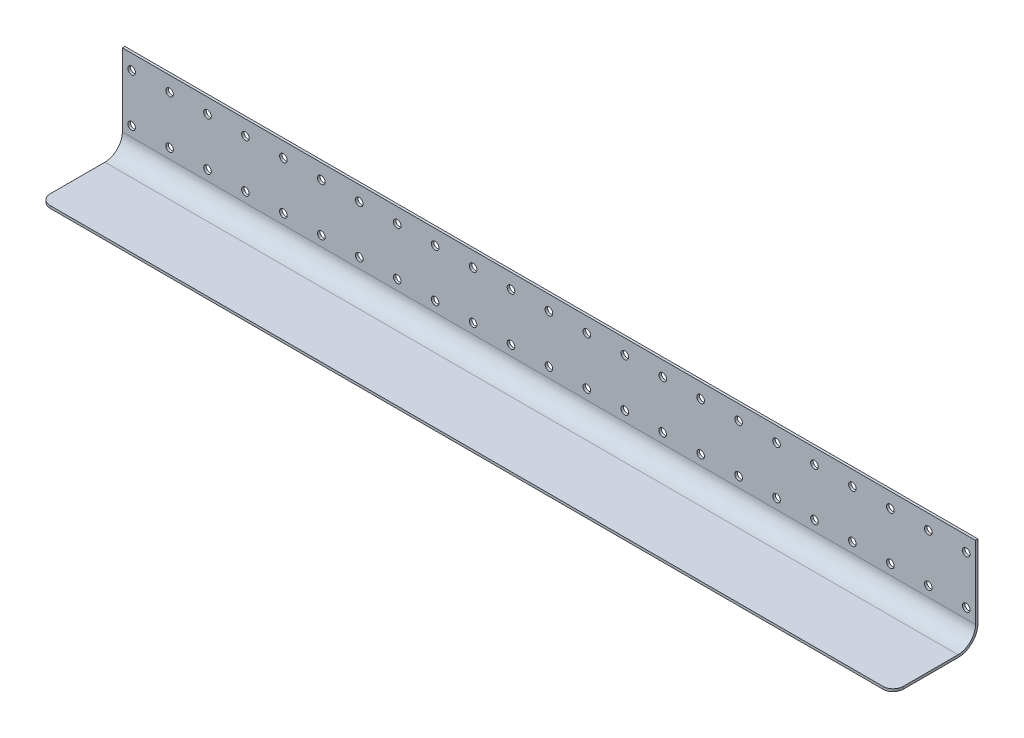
SolidWorks part; units mm, degrees
ref_plane "Front Plane" through (0, 0, 0) normal (1, 0, 0) x (0, 1, 0)
ref_plane "Top Plane" through (0, 0, 0) normal (0, 0, 1) x (0, 1, 0)
ref_plane "Right Plane" through (0, 0, 0) normal (0, 1, 0) x (-1, 0, 0)
sketch "sk 5dia hole pat" plane through (0, 0, 0) normal (0, 0, 1) x (0, 1, 0)
  line L4 (-30.48, -48.26) -> (30.48, -48.26) construction
  point P3 (0, -48.26)
  circle B0 centre (30.48, -579.12) radius 4.826
  circle B1 centre (1188.72, 579.12) radius 4.826
  circle B2 centre (78.74, -579.12) radius 4.826
  circle B3 centre (127, -579.12) radius 4.826
  circle B4 centre (175.26, -579.12) radius 4.826
  circle B5 centre (223.52, -579.12) radius 4.826
  circle B6 centre (271.78, -579.12) radius 4.826
  circle B7 centre (320.04, -579.12) radius 4.826
  circle B8 centre (368.3, -579.12) radius 4.826
  circle B9 centre (416.56, -579.12) radius 4.826
  circle B10 centre (464.82, -579.12) radius 4.826
  circle B11 centre (513.08, -579.12) radius 4.826
  circle B12 centre (561.34, -579.12) radius 4.826
  circle B13 centre (609.6, -579.12) radius 4.826
  circle B14 centre (657.86, -579.12) radius 4.826
  circle B15 centre (706.12, -579.12) radius 4.826
  circle B16 centre (754.38, -579.12) radius 4.826
  circle B17 centre (802.64, -579.12) radius 4.826
  circle B18 centre (850.9, -579.12) radius 4.826
  circle B19 centre (899.16, -579.12) radius 4.826
  circle B20 centre (947.42, -579.12) radius 4.826
  circle B21 centre (995.68, -579.12) radius 4.826
  circle B22 centre (1043.94, -579.12) radius 4.826
  circle B23 centre (1092.2, -579.12) radius 4.826
  circle B24 centre (1140.46, -579.12) radius 4.826
  circle B25 centre (1188.72, -579.12) radius 4.826
  circle B26 centre (30.48, -530.86) radius 4.826
  circle B27 centre (30.48, -482.6) radius 4.826
  circle B28 centre (30.48, -434.34) radius 4.826
  circle B29 centre (30.48, -386.08) radius 4.826
  circle B30 centre (30.48, -337.82) radius 4.826
  circle B31 centre (30.48, -289.56) radius 4.826
  circle B32 centre (30.48, -241.3) radius 4.826
  circle B33 centre (30.48, -193.04) radius 4.826
  circle B34 centre (30.48, -144.78) radius 4.826
  circle B35 centre (30.48, -96.52) radius 4.826
  circle B36 centre (30.48, -48.26) radius 4.826
  circle B37 centre (30.48, 0) radius 4.826
  circle B38 centre (30.48, 48.26) radius 4.826
  circle B39 centre (30.48, 96.52) radius 4.826
  circle B40 centre (30.48, 144.78) radius 4.826
  circle B41 centre (30.48, 193.04) radius 4.826
  circle B42 centre (30.48, 241.3) radius 4.826
  circle B43 centre (30.48, 289.56) radius 4.826
  circle B44 centre (30.48, 337.82) radius 4.826
  circle B45 centre (30.48, 386.08) radius 4.826
  circle B46 centre (30.48, 434.34) radius 4.826
  circle B47 centre (30.48, 482.6) radius 4.826
  circle B48 centre (30.48, 530.86) radius 4.826
  circle B49 centre (30.48, 579.12) radius 4.826
  circle B50 centre (1140.46, 579.12) radius 4.826
  circle B51 centre (1092.2, 579.12) radius 4.826
  circle B52 centre (1043.94, 579.12) radius 4.826
  circle B53 centre (995.68, 579.12) radius 4.826
  circle B54 centre (947.42, 579.12) radius 4.826
  circle B55 centre (899.16, 579.12) radius 4.826
  circle B56 centre (850.9, 579.12) radius 4.826
  circle B57 centre (802.64, 579.12) radius 4.826
  circle B58 centre (754.38, 579.12) radius 4.826
  circle B59 centre (706.12, 579.12) radius 4.826
  circle B60 centre (657.86, 579.12) radius 4.826
  circle B61 centre (609.6, 579.12) radius 4.826
  circle B62 centre (561.34, 579.12) radius 4.826
  circle B63 centre (513.08, 579.12) radius 4.826
  circle B64 centre (464.82, 579.12) radius 4.826
  circle B65 centre (416.56, 579.12) radius 4.826
  circle B66 centre (368.3, 579.12) radius 4.826
  circle B67 centre (320.04, 579.12) radius 4.826
  circle B68 centre (271.78, 579.12) radius 4.826
  circle B69 centre (223.52, 579.12) radius 4.826
  circle B70 centre (175.26, 579.12) radius 4.826
  circle B71 centre (127, 579.12) radius 4.826
  circle B72 centre (78.74, 579.12) radius 4.826
  circle B73 centre (1188.72, 530.86) radius 4.826
  circle B74 centre (1188.72, 482.6) radius 4.826
  circle B75 centre (1188.72, 434.34) radius 4.826
  circle B76 centre (1188.72, 386.08) radius 4.826
  circle B77 centre (1188.72, 337.82) radius 4.826
  circle B78 centre (1188.72, 289.56) radius 4.826
  circle B79 centre (1188.72, 241.3) radius 4.826
  circle B80 centre (1188.72, 193.04) radius 4.826
  circle B81 centre (1188.72, 144.78) radius 4.826
  circle B82 centre (1188.72, 96.52) radius 4.826
  circle B83 centre (1188.72, 48.26) radius 4.826
  circle B84 centre (1188.72, 0) radius 4.826
  circle B85 centre (1188.72, -48.26) radius 4.826
  circle B86 centre (1188.72, -96.52) radius 4.826
  circle B87 centre (1188.72, -144.78) radius 4.826
  circle B88 centre (1188.72, -193.04) radius 4.826
  circle B89 centre (1188.72, -241.3) radius 4.826
  circle B90 centre (1188.72, -289.56) radius 4.826
  circle B91 centre (1188.72, -337.82) radius 4.826
  circle B92 centre (1188.72, -386.08) radius 4.826
  circle B93 centre (1188.72, -434.34) radius 4.826
  circle B94 centre (1188.72, -482.6) radius 4.826
  circle B95 centre (1188.72, -530.86) radius 4.826
  line B96 (609.6, -579.12) -> (609.6, -504.12) construction
  line B97 (30.48, 0) -> (105.48, 0) construction
  circle B98 centre (-30.48, 579.12) radius 4.826
  circle B99 centre (-175.26, -579.12) radius 4.826
  circle B100 centre (-127, -579.12) radius 4.826
  circle B101 centre (-30.48, -579.12) radius 4.826
  circle B102 centre (-1188.72, 96.52) radius 4.826
  circle B103 centre (-127, 579.12) radius 4.826
  circle B104 centre (-464.82, 579.12) radius 4.826
  circle B105 centre (-513.08, 579.12) radius 4.826
  circle B106 centre (-706.12, 579.12) radius 4.826
  circle B107 centre (-754.38, 579.12) radius 4.826
  circle B108 centre (-899.16, 579.12) radius 4.826
  circle B109 centre (-30.48, 530.86) radius 4.826
  circle B110 centre (-30.48, 482.6) radius 4.826
  circle B111 centre (-30.48, 434.34) radius 4.826
  circle B112 centre (-30.48, 386.08) radius 4.826
  circle B113 centre (-30.48, 337.82) radius 4.826
  circle B114 centre (-30.48, 289.56) radius 4.826
  circle B115 centre (-30.48, 241.3) radius 4.826
  circle B116 centre (-30.48, 193.04) radius 4.826
  circle B117 centre (-30.48, 144.78) radius 4.826
  circle B118 centre (-30.48, 96.52) radius 4.826
  circle B119 centre (-30.48, 48.26) radius 4.826
  circle B120 centre (-30.48, 0) radius 4.826
  circle B121 centre (-30.48, -48.26) radius 4.826
  circle B122 centre (-30.48, -96.52) radius 4.826
  circle B123 centre (-30.48, -144.78) radius 4.826
  circle B124 centre (-30.48, -241.3) radius 4.826
  circle B125 centre (-30.48, -289.56) radius 4.826
  circle B126 centre (-30.48, -337.82) radius 4.826
  circle B127 centre (-30.48, -386.08) radius 4.826
  circle B128 centre (-30.48, -434.34) radius 4.826
  circle B129 centre (-30.48, -482.6) radius 4.826
  circle B130 centre (-30.48, -530.86) radius 4.826
  line B131 (-1188.72, 0) -> (-1113.72, 0) construction
  dimension "D1" = 60.96
sketch_block_instance "5dia hole pat-1"
sketch_block "5dia hole pat" parameters "D1"=9.652, "D2"=9.652, "D3"=75
sketch_block_instance "5dia hole pat-2"
sketch "sk 47.986in pnl" plane through (0, 0, 0) normal (0, 0, 1) x (0, 1, 0)
  line B0 (0.1778, 0) -> (1219.0222, 0) construction
  line B1 (0.1778, 609.4222) -> (1219.0222, 609.4222)
  line B2 (0.1778, 609.4222) -> (0.1778, -609.4222)
  line B3 (0.1778, -609.4222) -> (1219.0222, -609.4222)
  line B4 (1219.0222, 609.4222) -> (1219.0222, -609.4222)
  line B5 (609.6, 609.4222) -> (609.6, -609.4222) construction
  dimension "D1" = 30.3022
sketch_block_instance "47.986in pnl-1"
sketch_block "47.986in pnl" parameters "D1"=1218.8444, "D2"=1218.8444
sketch "sk main body" plane through (0, 0, 0) normal (1, 0, 0) x (0, 1, 0)
  line L0 (49.53, 0) -> (-43.18, 0)
  line L1 (-68.58, 25.4) -> (-68.58, 158.75)
  line L2 (-43.18, 184.15) -> (-7.62, 184.15)
  line L3 (-26.67, 213.8401) -> (-26.67, 147.2198) construction
  line L4 (49.53, 3.175) -> (-43.18, 3.175)
  line L5 (-65.405, 25.4) -> (-65.405, 158.75)
  line L6 (-43.18, 180.975) -> (-7.62, 180.975)
  line L7 (-7.62, 184.15) -> (-7.62, 180.975)
  line L8 (49.53, 3.175) -> (49.53, 0)
  line L9 (670.3644, 0) -> (-670.3644, 0) construction
  arc A0 (-43.18, 0) -> (-68.58, 25.4) centre (-43.18, 25.4) cw
  arc A1 (-68.58, 158.75) -> (-43.18, 184.15) centre (-43.18, 158.75) cw
  arc A2 (-43.18, 3.175) -> (-65.405, 25.4) centre (-43.18, 25.4) cw
  arc A3 (-65.405, 158.75) -> (-43.18, 180.975) centre (-43.18, 158.75) cw
  dimension "D2" = 25.4
  dimension "D1" = 19.05
  dimension "D3" = 12.7
  dimension "D4" = 16.51
  dimension "D5" = 19.05
  dimension "D7" = 177.8
  dimension "D6" = 3.175
extrude "main body" add sketch "sk main body" along normal mid plane 1218.8444
sketch "sk upper holes" plane through (0, 0, 184.15) normal (0, 0, 1) x (1, 0, 0)
  line L0 (-609.4222, 0.1778) -> (-609.4222, 1219.0222) construction
  line L1 (609.4222, 0.1778) -> (609.4222, 1219.0222) construction
  line L2 (609.4222, -7.62) -> (-609.4222, -7.62) construction
  circle A2 centre (-342.9, -26.67) radius 16.51 construction
  circle A3 centre (-266.7, -26.67) radius 16.51 construction
  circle A4 centre (266.7, -26.67) radius 16.51 construction
  circle A5 centre (342.9, -26.67) radius 16.51 construction
  line B0 (-342.9, -26.67) -> (-266.7, -26.67) construction
  circle B1 centre (-342.9, -26.67) radius 7.1438
  circle B2 centre (-266.7, -26.67) radius 7.1438
  line B3 (266.7, -26.67) -> (342.9, -26.67) construction
  circle B4 centre (266.7, -26.67) radius 7.1438
  circle B5 centre (342.9, -26.67) radius 7.1438
  dimension "D1" = 304.8
  dimension "D2" = 304.8
  dimension "D6" = 33.02
  dimension "D7" = 33.02
  dimension "D8" = 33.02
  dimension "D9" = 33.02
  dimension "D3" = 304.6222
  dimension "D4" = 304.6222
  dimension "D5" = 19.05
sketch_block_instance "Upper bolt holes-1"
sketch_block "Upper bolt holes" parameters "D1"=14.2875, "D2"=14.2875, "D3"=76.2
sketch_block_instance "Upper bolt holes-2"
sketch "Sketch6" plane through (0, 0, 184.15) normal (0, 0, 1) x (1, 0, 0)
  line L0 (-371.4962, -43.18) -> (-304.8, 72.3411)
  line L1 (609.4222, -43.18) -> (-609.4222, -43.18) construction
  line L2 (-304.8, 72.3411) -> (-238.1038, -43.18)
  line L3 (-371.4962, -43.18) -> (-638.8127, -43.18)
  line L4 (-638.8127, -43.18) -> (-638.8127, 115.8831)
  line L6 (238.1038, -43.18) -> (304.8, 72.3411)
  line L7 (304.8, 72.3411) -> (371.4962, -43.18)
  line L8 (371.4962, -43.18) -> (645.1619, -43.18)
  line L9 (645.1619, -43.18) -> (645.1619, 115.8831)
  line L10 (-238.1038, -43.18) -> (238.1038, -43.18)
  line L11 (-638.8127, 115.8831) -> (645.1619, 115.8831)
  circle A0 centre (-342.9, -26.67) radius 16.51 construction
  circle A1 centre (-266.7, -26.67) radius 16.51 construction
  circle A2 centre (342.9, -26.67) radius 16.51 construction
  circle A3 centre (266.7, -26.67) radius 16.51 construction
  dimension "D1" = 60
  dimension "D2" = 60
  dimension "D3" = 60
  dimension "D4" = 60
extrude "Upper tabs" cut sketch "Sketch6" against normal blind 10
sketch "Sketch7" [suppressed] plane through (0, 0, 0) normal (0, 1, 0) x (-1, 0, 0)
  line L0 (-238.1038, 180.975) -> (-238.1038, 196.2087)
  line L4 (-238.1038, 196.2087) -> (238.1038, 196.2087)
  line L5 (238.1038, 196.2087) -> (238.1038, 180.975)
  line L6 (-609.4222, 25.4) -> (609.4222, 25.4) construction
  arc A2 (-238.1038, 180.975) -> (238.1038, 180.975) centre (0, 399.136) ccw
  point P2 (0, 76.2)
  dimension "D1" = 50.8
sketch "5dia hole for part" plane through (0, 0, 0) normal (0, 0, 1) x (0, 1, 0)
  circle A0 centre (-30.48, -579.12) radius 4.826
  circle A1 centre (30.48, -579.12) radius 4.826
  circle A2 centre (-30.48, -579.12) radius 4.826 construction
  circle A3 centre (30.48, -579.12) radius 4.826 construction
  circle A4 centre (-30.48, -530.86) radius 4.826
  circle A5 centre (30.48, -530.86) radius 4.826
  circle A6 centre (-30.48, -482.6) radius 4.826
  circle A7 centre (30.48, -482.6) radius 4.826
  circle A8 centre (-30.48, -434.34) radius 4.826
  circle A9 centre (30.48, -434.34) radius 4.826
  circle A10 centre (-30.48, -386.08) radius 4.826
  circle A11 centre (30.48, -386.08) radius 4.826
  circle A12 centre (-30.48, -337.82) radius 4.826
  circle A13 centre (30.48, -337.82) radius 4.826
  circle A14 centre (-30.48, -289.56) radius 4.826
  circle A15 centre (30.48, -289.56) radius 4.826
  circle A16 centre (-30.48, -241.3) radius 4.826
  circle A17 centre (30.48, -241.3) radius 4.826
  circle A18 centre (-30.48, -193.04) radius 4.826
  circle A19 centre (30.48, -193.04) radius 4.826
  circle A20 centre (-30.48, -144.78) radius 4.826
  circle A21 centre (30.48, -144.78) radius 4.826
  circle A22 centre (-30.48, -96.52) radius 4.826
  circle A23 centre (30.48, -96.52) radius 4.826
  circle A24 centre (-30.48, -48.26) radius 4.826
  circle A25 centre (30.48, -48.26) radius 4.826
  circle A26 centre (-30.48, 0) radius 4.826
  circle A27 centre (30.48, 0) radius 4.826
  circle A28 centre (-30.48, 48.26) radius 4.826
  circle A29 centre (30.48, 48.26) radius 4.826
  circle A30 centre (-30.48, 96.52) radius 4.826
  circle A31 centre (30.48, 96.52) radius 4.826
  circle A32 centre (-30.48, 144.78) radius 4.826
  circle A33 centre (30.48, 144.78) radius 4.826
  circle A34 centre (-30.48, 193.04) radius 4.826
  circle A35 centre (30.48, 193.04) radius 4.826
  circle A36 centre (-30.48, 241.3) radius 4.826
  circle A37 centre (30.48, 241.3) radius 4.826
  circle A38 centre (-30.48, 289.56) radius 4.826
  circle A39 centre (30.48, 289.56) radius 4.826
  circle A40 centre (-30.48, 337.82) radius 4.826
  circle A41 centre (30.48, 337.82) radius 4.826
  circle A42 centre (-30.48, 386.08) radius 4.826
  circle A43 centre (30.48, 386.08) radius 4.826
  circle A44 centre (-30.48, 434.34) radius 4.826
  circle A45 centre (30.48, 434.34) radius 4.826
  circle A46 centre (-30.48, 482.6) radius 4.826
  circle A47 centre (30.48, 482.6) radius 4.826
  circle A48 centre (-30.48, 530.86) radius 4.826
  circle A49 centre (30.48, 530.86) radius 4.826
  circle A50 centre (-30.48, 579.12) radius 4.826
  circle A51 centre (30.48, 579.12) radius 4.826
  dimension "D1" = 25
extrude "Holes Bot" cut sketch "5dia hole for part" along normal blind 10
sketch "Sketch8" plane through (0, 0, 0) normal (0, 1, 0) x (-1, 0, 0)
  line L0 (-609.4222, 25.4) -> (609.4222, 25.4) construction
  line L1 (-659.7465, 264.9899) -> (644.9755, 264.9899)
  line L2 (-659.7465, 264.9899) -> (-659.7465, 107.95)
  line L3 (-659.7465, 107.95) -> (644.9755, 107.95)
  line L4 (644.9755, 264.9899) -> (644.9755, 107.95)
  dimension "D1" = 82.55
extrude "Cut-Extrude1" cut sketch "Sketch8" against normal through all both and the other way through all
sketch "Sketch9" plane through (0, 0, 0) normal (0, 0, 1) x (0, 1, 0)
  line L1 (-181.4602, 542.6759) -> (183.3482, 542.6759)
  line L2 (-181.4602, 542.6759) -> (-181.4602, -542.6759)
  line L3 (-181.4602, -542.6759) -> (183.3482, -542.6759)
  line L4 (183.3482, 542.6759) -> (183.3482, -542.6759)
  line L5 (-482.1265, 719.2812) -> (492.0322, 719.2812)
  line L6 (-482.1265, 719.2812) -> (-482.1265, -780.0412)
  line L7 (-482.1265, -780.0412) -> (492.0322, -780.0412)
  line L8 (492.0322, 719.2812) -> (492.0322, -780.0412)
  point P8 (183.3482, 0)
  dimension "D1" = 1085.3518
extrude "Cut-Extrude2" cut sketch "Sketch9" along normal through all both and the other way through all
fillet "Fillet1" radius 13 2 edges at (-542.6759, -66.9925, 107.95) (542.6759, -66.9925, 107.95)
equation "\"3i\"=138.375"
equation "\".75i\"=12.7"
